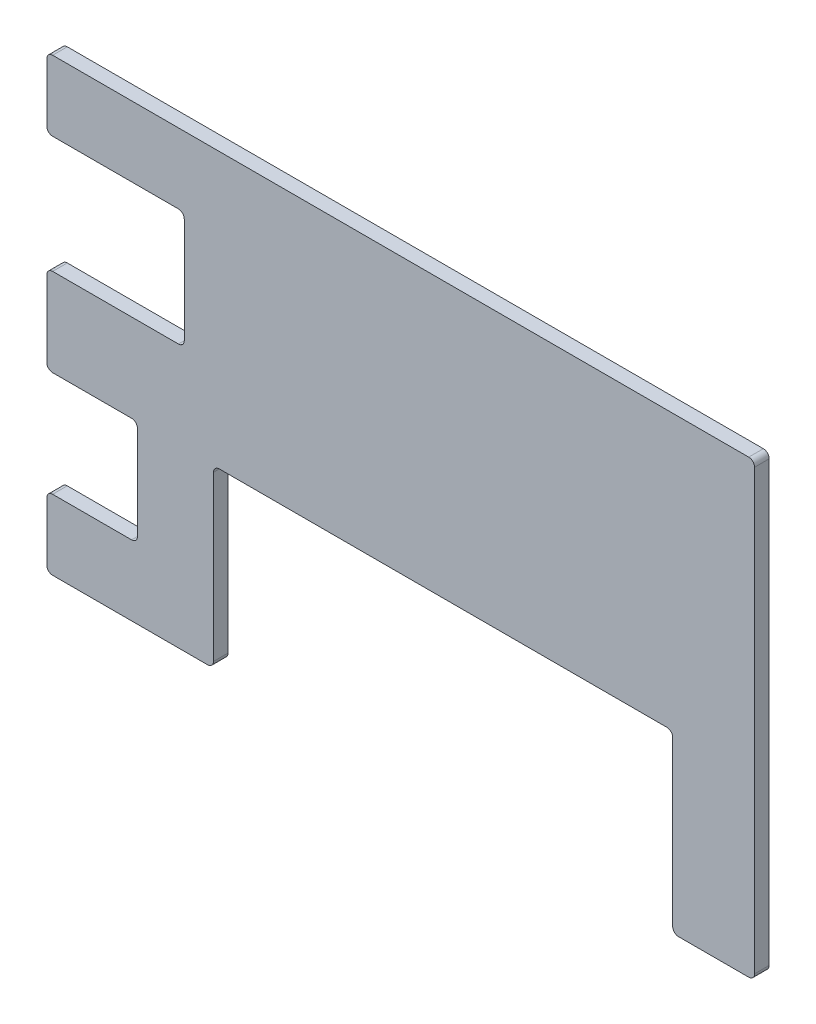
SolidWorks part; units mm, degrees
ref_plane "Front Plane" through (0, 0, 0) normal (0, 0, 1) x (1, 0, 0)
ref_plane "Top Plane" through (0, 0, 0) normal (0, 1, 0) x (1, 0, 0)
ref_plane "Right Plane" through (0, 0, 0) normal (1, 0, 0) x (0, 0, -1)
sketch "Sketch2" plane through (0, 0, 0) normal (0, 0, 1) x (1, 0, 0)
  line L0 (-60.5, 37) -> (-60.5, 27)
  line L1 (-59.5, 26) -> (-38, 26)
  line L2 (-37, 25) -> (-37, 7)
  line L3 (-38, 6) -> (-59.5, 6)
  line L4 (-60.5, 5) -> (-60.5, -8)
  line L5 (-59.5, -9) -> (-46, -9)
  line L6 (-45, -10) -> (-45, -26)
  line L7 (-46, -27) -> (-59.5, -27)
  line L8 (-60.5, -28) -> (-60.5, -38)
  line L9 (-59.5, -39) -> (-33, -39)
  line L10 (-32, -38) -> (-32, -10)
  line L11 (-31, -9) -> (45.5, -9)
  line L12 (46.5, -10) -> (46.5, -38)
  line L13 (47.5, -39) -> (59.5, -39)
  line L14 (60.5, -38) -> (60.5, 37)
  line L15 (59.5, 38) -> (-59.5, 38)
  arc A0 (-59.5, 38) -> (-60.5, 37) centre (-59.5, 37) ccw
  circle A1 centre (-59.5, 38) radius 0.0375
  circle A2 centre (-60.5, 37) radius 0.0375
  circle A3 centre (-60.5, 37) radius 0.0375
  circle A4 centre (-60.5, 27) radius 0.0375
  arc A5 (-60.5, 27) -> (-59.5, 26) centre (-59.5, 27) ccw
  circle A6 centre (-60.5, 27) radius 0.0375
  circle A7 centre (-59.5, 26) radius 0.0375
  circle A8 centre (-59.5, 26) radius 0.0375
  circle A9 centre (-38, 26) radius 0.0375
  arc A10 (-37, 25) -> (-38, 26) centre (-38, 25) ccw
  circle A11 centre (-38, 26) radius 0.0375
  circle A12 centre (-37, 25) radius 0.0375
  circle A13 centre (-37, 25) radius 0.0375
  circle A14 centre (-37, 7) radius 0.0375
  arc A15 (-38, 6) -> (-37, 7) centre (-38, 7) ccw
  circle A16 centre (-37, 7) radius 0.0375
  circle A17 centre (-38, 6) radius 0.0375
  circle A18 centre (-38, 6) radius 0.0375
  circle A19 centre (-59.5, 6) radius 0.0375
  arc A20 (-59.5, 6) -> (-60.5, 5) centre (-59.5, 5) ccw
  circle A21 centre (-59.5, 6) radius 0.0375
  circle A22 centre (-60.5, 5) radius 0.0375
  circle A23 centre (-60.5, 5) radius 0.0375
  circle A24 centre (-60.5, -8) radius 0.0375
  arc A25 (-60.5, -8) -> (-59.5, -9) centre (-59.5, -8) ccw
  circle A26 centre (-60.5, -8) radius 0.0375
  circle A27 centre (-59.5, -9) radius 0.0375
  circle A28 centre (-59.5, -9) radius 0.0375
  circle A29 centre (-46, -9) radius 0.0375
  arc A30 (-45, -10) -> (-46, -9) centre (-46, -10) ccw
  circle A31 centre (-46, -9) radius 0.0375
  circle A32 centre (-45, -10) radius 0.0375
  circle A33 centre (-45, -10) radius 0.0375
  circle A34 centre (-45, -26) radius 0.0375
  arc A35 (-46, -27) -> (-45, -26) centre (-46, -26) ccw
  circle A36 centre (-45, -26) radius 0.0375
  circle A37 centre (-46, -27) radius 0.0375
  circle A38 centre (-46, -27) radius 0.0375
  circle A39 centre (-59.5, -27) radius 0.0375
  arc A40 (-59.5, -27) -> (-60.5, -28) centre (-59.5, -28) ccw
  circle A41 centre (-59.5, -27) radius 0.0375
  circle A42 centre (-60.5, -28) radius 0.0375
  circle A43 centre (-60.5, -28) radius 0.0375
  circle A44 centre (-60.5, -38) radius 0.0375
  arc A45 (-60.5, -38) -> (-59.5, -39) centre (-59.5, -38) ccw
  circle A46 centre (-60.5, -38) radius 0.0375
  circle A47 centre (-59.5, -39) radius 0.0375
  circle A48 centre (-59.5, -39) radius 0.0375
  circle A49 centre (-33, -39) radius 0.0375
  arc A50 (-33, -39) -> (-32, -38) centre (-33, -38) ccw
  circle A51 centre (-33, -39) radius 0.0375
  circle A52 centre (-32, -38) radius 0.0375
  circle A53 centre (-32, -38) radius 0.0375
  circle A54 centre (-32, -10) radius 0.0375
  arc A55 (-31, -9) -> (-32, -10) centre (-31, -10) ccw
  circle A56 centre (-32, -10) radius 0.0375
  circle A57 centre (-31, -9) radius 0.0375
  circle A58 centre (-31, -9) radius 0.0375
  circle A59 centre (45.5, -9) radius 0.0375
  arc A60 (46.5, -10) -> (45.5, -9) centre (45.5, -10) ccw
  circle A61 centre (45.5, -9) radius 0.0375
  circle A62 centre (46.5, -10) radius 0.0375
  circle A63 centre (46.5, -10) radius 0.0375
  circle A64 centre (46.5, -38) radius 0.0375
  arc A65 (46.5, -38) -> (47.5, -39) centre (47.5, -38) ccw
  circle A66 centre (46.5, -38) radius 0.0375
  circle A67 centre (47.5, -39) radius 0.0375
  circle A68 centre (47.5, -39) radius 0.0375
  circle A69 centre (59.5, -39) radius 0.0375
  arc A70 (59.5, -39) -> (60.5, -38) centre (59.5, -38) ccw
  circle A71 centre (59.5, -39) radius 0.0375
  circle A72 centre (60.5, -38) radius 0.0375
  circle A73 centre (60.5, -38) radius 0.0375
  circle A74 centre (60.5, 37) radius 0.0375
  arc A75 (60.5, 37) -> (59.5, 38) centre (59.5, 37) ccw
  circle A76 centre (60.5, 37) radius 0.0375
  circle A77 centre (59.5, 38) radius 0.0375
  circle A78 centre (59.5, 38) radius 0.0375
  circle A79 centre (-59.5, 38) radius 0.0375
extrude "Boss-Extrude1" add sketch "Sketch2" along normal blind 2.5 contours L15 A0 L0 A5 L1 A10 L2 A15 L3 A20 L4 A25 L5 A30 L6 A35 L7 A40 L8 A45 L9 A50 L10 A55 L11 A60 L12 A65 L13 A70 L14 A75
